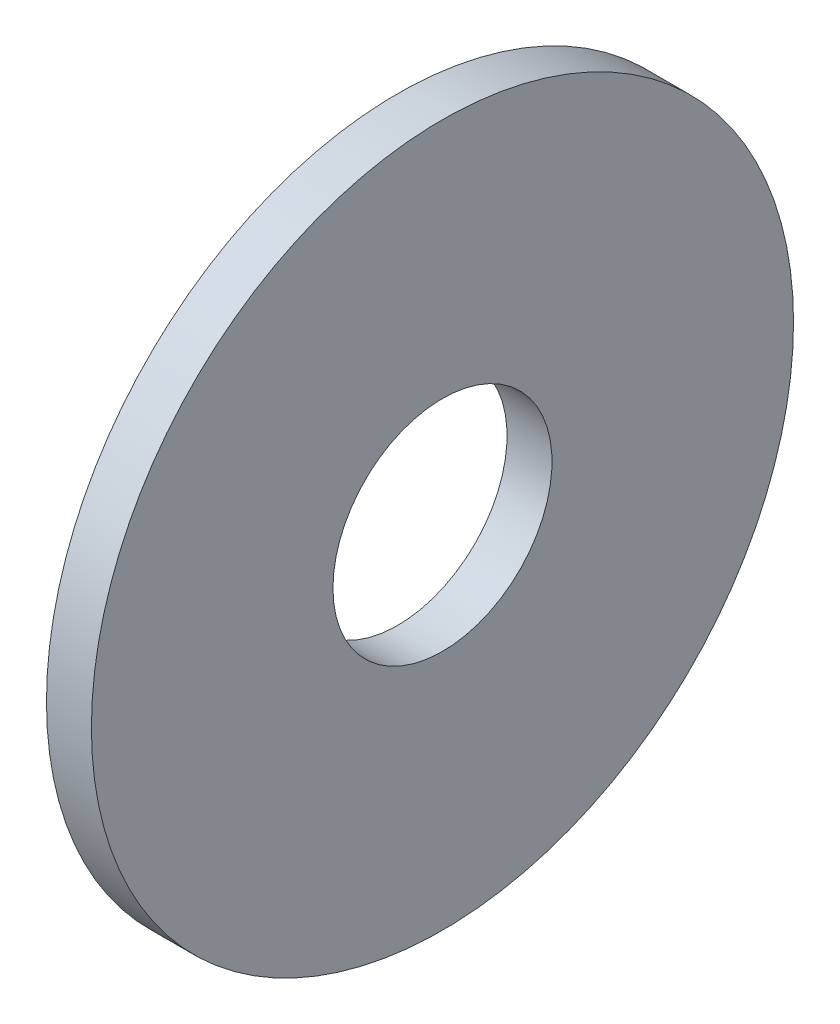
SolidWorks part; units mm, degrees
ref_plane "Plane1" through (0, 0, 0) normal (0, 0, 1) x (1, 0, 0)
ref_plane "Plane2" through (0, 0, 0) normal (0, 1, 0) x (1, 0, 0)
ref_plane "Plane3" through (0, 0, 0) normal (1, 0, 0) x (0, 0, -1)
other "Configuration Table"
sketch "Sketch1" plane through (0, 0, 0) normal (0, 0, 1) x (1, 0, 0)
  line L0 (-34.925, 0) -> (9.525, 0) construction
  line L1 (0, 19.5) -> (0, 62.5)
  line L2 (0, 62.5) -> (-8, 62.5)
  line L3 (-8, 62.5) -> (-8, 19.5)
  line L4 (-8, 19.5) -> (0, 19.5)
  dimension "Thickness" = 8
  dimension "Inside_dia" = 39
  dimension "Outside_dia" = 125
revolve "Base-Revolve" add sketch "Sketch1" angle 360 about L0
